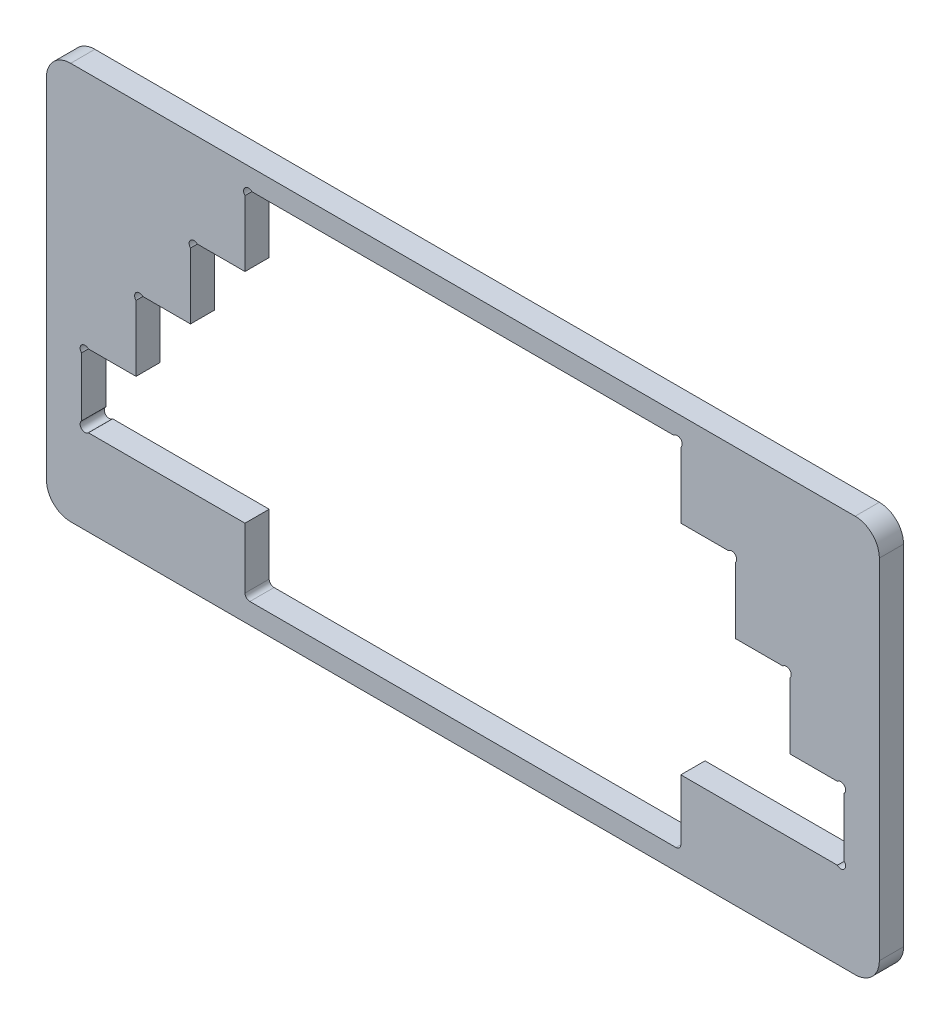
SolidWorks part; units mm, degrees
ref_plane "Plan de face" through (0, 0, 0) normal (0, 0, 1) x (1, 0, 0)
ref_plane "Plan de dessus" through (0, 0, 0) normal (0, 1, 0) x (1, 0, 0)
ref_plane "Plan de droite" through (0, 0, 0) normal (1, 0, 0) x (0, 0, -1)
sketch "Esquisse1" plane through (0, 0, 0) normal (0, 0, 1) x (1, 0, 0)
  line L0 (0, 0) -> (470.6608, 0) construction
  line L1 (0, -55.3377) -> (0, 353.7921) construction
  line L2 (126.342, 15) -> (142.1021, 15) construction
  line L3 (-48.9983, 46.5) -> (-10.5145, 46.5) construction
  line L4 (-351.5978, -35.5) -> (246.5654, -35.5) construction
  line L5 (-200.5397, 128.5) -> (246.5654, 128.5) construction
  line L6 (157.5, 0) -> (144.8818, 12.6182) construction
  line L7 (135, 60) -> (120.4686, 45.4686) construction
  line L8 (112.5, 90) -> (97.4891, 74.9891) construction
  line L9 (90, 120) -> (75.062, 105.062) construction
  line L10 (0, 0) -> (-470.6608, 0) construction
  line L11 (-390.3547, -27) -> (366.2536, -27) construction
  line L12 (-390.3547, 30) -> (366.2536, 30) construction
  line L13 (-390.3547, 60) -> (366.2536, 60) construction
  line L14 (22.5, -55.3377) -> (22.5, 160.9755) construction
  line L15 (366.2536, 90) -> (-390.3547, 90) construction
  line L16 (45, -55.3377) -> (45, 160.9755) construction
  line L17 (-390.3547, 120) -> (366.2536, 120) construction
  line L18 (157.5, 27.1716) -> (157.5, 2.8284)
  line L19 (90, 117.1716) -> (90, 90)
  line L20 (67.5, -55.3377) -> (67.5, 160.9755) construction
  line L21 (90, -55.3377) -> (90, 160.9755) construction
  line L22 (112.5, -55.3377) -> (112.5, 160.9755) construction
  line L23 (135, -55.3377) -> (135, 160.9755) construction
  line L24 (157.5, -55.3377) -> (157.5, 160.9755) construction
  line L25 (90, 90) -> (109.6716, 90)
  line L26 (112.5, 87.1716) -> (112.5, 60)
  line L27 (112.5, 60) -> (132.1716, 60)
  line L28 (0, 0) -> (442.2765, 160.9755) construction
  line L29 (0, 0) -> (360.5471, 302.5349) construction
  line L30 (0, 0) -> (235.3304, 407.6042) construction
  line L31 (0, 0) -> (81.7294, 463.5104) construction
  line L32 (0, 0) -> (-81.7294, 463.5104) construction
  line L33 (0, 0) -> (-235.3304, 407.6042) construction
  line L34 (0, 0) -> (-360.5471, 302.535) construction
  line L35 (0, 0) -> (-442.2765, 160.9755) construction
  line L36 (180, -55.3377) -> (180, 160.9755) construction
  line L37 (202.5, -55.3377) -> (202.5, 160.9755) construction
  line L38 (225, -55.3377) -> (225, 160.9755) construction
  line L39 (135, 57.1716) -> (135, 30)
  line L40 (135, 30) -> (154.6716, 30)
  line L41 (172, 203.316) -> (172, -67.4387) construction
  line L42 (172, 118.5) -> (172, -25.5)
  line L43 (154.6716, 0) -> (90, 0)
  line L44 (90, 0) -> (90, -25)
  line L45 (-172, 118.5) -> (-172, -25.5)
  line L46 (-90, 0) -> (-90, -25)
  line L47 (-154.6716, 0) -> (-90, 0)
  line L48 (-157.5, 27.1716) -> (-157.5, 2.8284)
  line L49 (-135, 30) -> (-154.6716, 30)
  line L50 (-135, 57.1716) -> (-135, 30)
  line L51 (-112.5, 60) -> (-132.1716, 60)
  line L52 (-112.5, 87.1716) -> (-112.5, 60)
  line L53 (-90, 90) -> (-109.6716, 90)
  line L54 (-90, 117.1716) -> (-90, 90)
  line L55 (-162, 128.5) -> (162, 128.5)
  line L56 (-87.1716, 120) -> (87.1716, 120)
  line L57 (-88, -27) -> (88, -27)
  line L58 (162, -35.5) -> (-162, -35.5)
  arc A0 (90, 0) -> (0, 90) centre (0, 0) ccw construction
  arc A1 (112, 0) -> (0, 112) centre (0, 0) ccw construction
  arc A2 (154.6716, 0) -> (157.5, 2.8284) centre (156.0858, 1.4142) ccw
  arc A3 (154.6716, 30) -> (157.5, 27.1716) centre (156.0858, 28.5858) cw
  arc A4 (135, 57.1716) -> (132.1716, 60) centre (133.5858, 58.5858) ccw
  arc A5 (112.5, 87.1716) -> (109.6716, 90) centre (111.0858, 88.5858) ccw
  arc A6 (90, 117.1716) -> (87.1716, 120) centre (88.5858, 118.5858) ccw
  arc A7 (-154.6716, 0) -> (-157.5, 2.8284) centre (-156.0858, 1.4142) cw
  arc A8 (-154.6716, 30) -> (-157.5, 27.1716) centre (-156.0858, 28.5858) ccw
  arc A9 (-135, 57.1716) -> (-132.1716, 60) centre (-133.5858, 58.5858) cw
  arc A10 (-112.5, 87.1716) -> (-109.6716, 90) centre (-111.0858, 88.5858) cw
  arc A11 (-90, 117.1716) -> (-87.1716, 120) centre (-88.5858, 118.5858) cw
  arc A12 (172, -25.5) -> (162, -35.5) centre (162, -25.5) cw
  arc A13 (172, 118.5) -> (162, 128.5) centre (162, 118.5) ccw
  arc A14 (-172, 118.5) -> (-162, 128.5) centre (-162, 118.5) cw
  arc A15 (-172, -25.5) -> (-162, -35.5) centre (-162, -25.5) ccw
  arc A16 (90, -25) -> (88, -27) centre (88, -25) cw
  arc A17 (-90, -25) -> (-88, -27) centre (-88, -25) ccw
  point P119 (172, -35.5)
  point P122 (172, 128.5)
  point P125 (-172, 128.5)
  point P128 (-172, -35.5)
  point P131 (90, -27)
  point P134 (-90, -27)
  dimension "D1" = 73.5
  dimension "D8" = 172
  dimension "D9" = 10
  dimension "D10" = 2
  dimension "D2" = 82
  dimension "D3" = 164
  dimension "D4" = 45
  dimension "D5" = 45
  dimension "D6" = 45
  dimension "D7" = 45
extrude "Extrusion1" add sketch "Esquisse1" along normal blind 10
